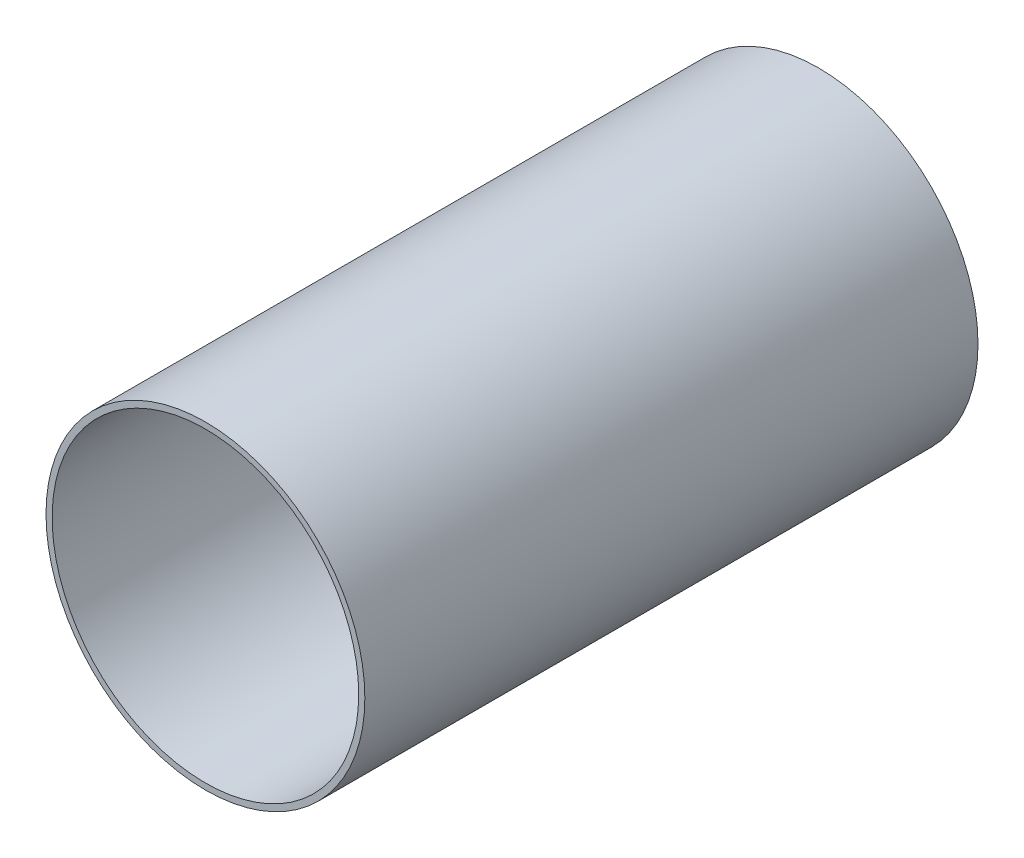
SolidWorks part; units mm, degrees
ref_plane "Płaszczyzna przednia" through (0, 0, 0) normal (0, 0, 1) x (1, 0, 0)
ref_plane "Płaszczyzna górna" through (0, 0, 0) normal (0, 1, 0) x (1, 0, 0)
ref_plane "Płaszczyzna prawa" through (0, 0, 0) normal (1, 0, 0) x (0, 0, -1)
sketch "Szkic1" plane through (0, 0, 0) normal (0, 0, 1) x (1, 0, 0)
  circle A0 centre (0, 0) radius 50
  dimension "D1" = 100
extrude "Wyciągnięcie-cienka ścianka1" add sketch "Szkic1" along normal mid plane 200 thin
sketch "Szkic2" plane through (0, 0, 0) normal (1, 0, 0) x (0, 0, -1)
  line L0 (-43.3013, 25) -> (43.3013, -25) construction
  line L1 (-38.3013, 33.6603) -> (48.3013, -16.3397)
  line L2 (-48.3013, 16.3397) -> (38.3013, -33.6603)
  line L3 (-100, 0) -> (100, 0) construction
  arc A0 (-38.3013, 33.6603) -> (-48.3013, 16.3397) centre (-43.3013, 25) ccw
  arc A1 (38.3013, -33.6603) -> (48.3013, -16.3397) centre (43.3013, -25) ccw
  point P2 (0, 0)
  dimension "D3" = 10
  dimension "D1" = 30
  dimension "D2" = 100
extrude "Wytnij-wyciągnięcie1" cut sketch "Szkic2" against normal through all
